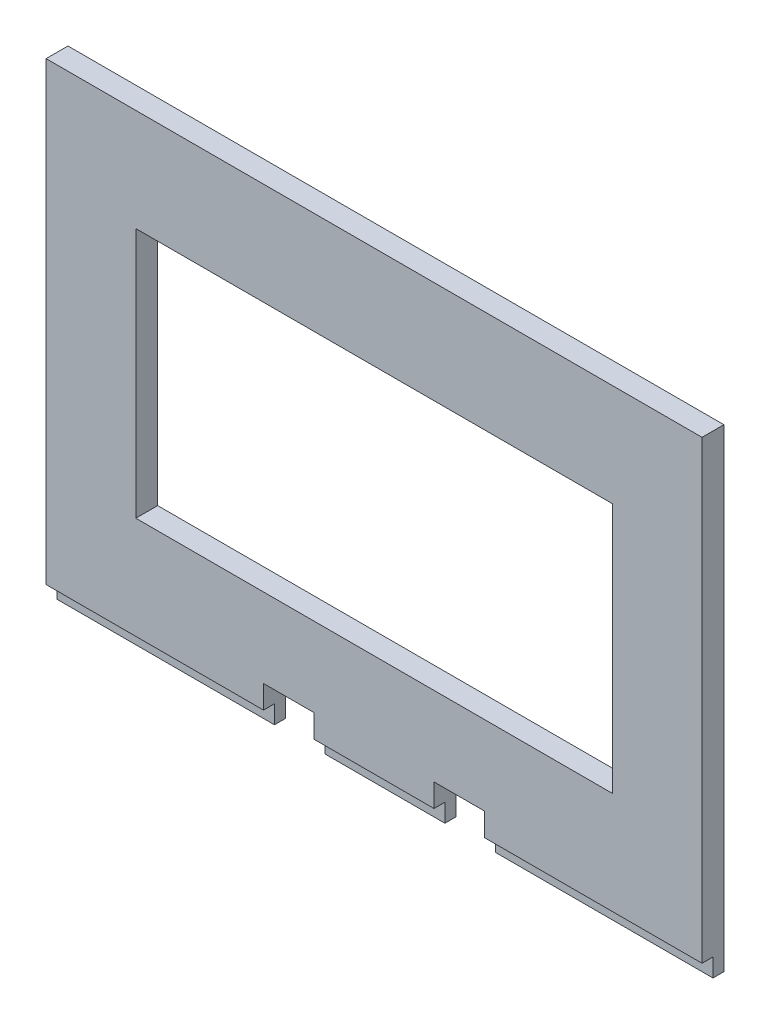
SolidWorks part; units mm, degrees
ref_plane "前视基准面" through (0, 0, 0) normal (0, 0, 1) x (1, 0, 0)
ref_plane "上视基准面" through (0, 0, 0) normal (0, 1, 0) x (1, 0, 0)
ref_plane "右视基准面" through (0, 0, 0) normal (1, 0, 0) x (0, 0, -1)
other "Configuration Table"
sketch "草图1" plane through (0, 0, 0) normal (0, 0, 1) x (1, 0, 0)
  line L1 (90, -62.5) -> (-90, -62.5)
  line L2 (90, -62.5) -> (90, 62.5)
  line L3 (90, 62.5) -> (-90, 62.5)
  line L4 (-90, -62.5) -> (-90, 62.5)
  line L5 (90, -62.5) -> (-90, 62.5) construction
  line L6 (90, 62.5) -> (-90, -62.5) construction
  point P0 (0, 0)
  dimension "D1" = 180
  dimension "D2" = 125
extrude "凸台-拉伸1" add sketch "草图1" along normal blind 4
sketch "草图2" plane through (0, 0, 4) normal (0, 0, 1) x (1, 0, 0)
  line L0 (-90, 62.5) -> (-90, -62.5)
  line L1 (-90, -62.5) -> (90, -62.5)
  line L2 (90, -62.5) -> (90, 62.5)
  line L3 (90, 62.5) -> (-90, 62.5)
extrude "凸台-拉伸2" add sketch "草图2" along normal blind 2
sketch "草图3" plane through (0, -62.5, 0) normal (0, -1, 0) x (1, 0, 0)
  line L0 (90, 0) -> (90, 3)
  line L2 (90, 6) -> (90, 0) construction
  line L3 (90, 3) -> (-90, 3)
  line L4 (-90, 6) -> (-90, 0) construction
  line L5 (-90, 3) -> (-90, 0)
  line L6 (90, 0) -> (-90, 0)
extrude "凸台-拉伸3" add sketch "草图3" along normal blind 5
sketch "草图4" plane through (0, 0, 6) normal (0, 0, 1) x (1, 0, 0)
  line L1 (65.3847, -34.4209) -> (-65.3847, -34.4209)
  line L2 (65.3847, -34.4209) -> (65.3847, 34.4209)
  line L3 (65.3847, 34.4209) -> (-65.3847, 34.4209)
  line L4 (-65.3847, -34.4209) -> (-65.3847, 34.4209)
  line L5 (65.3847, -34.4209) -> (-65.3847, 34.4209) construction
  line L6 (65.3847, 34.4209) -> (-65.3847, -34.4209) construction
  point P0 (0, 0)
extrude "切除-拉伸1" cut sketch "草图4" against normal through all
sketch "草图6" plane through (0, 0, 0) normal (0, 0, -1) x (-1, 0, 0)
  line L0 (-30.3326, -67.5) -> (-30.3326, -56.171)
  line L1 (90, -67.5) -> (-90, -67.5) construction
  line L2 (-30.3326, -56.171) -> (-16.4469, -56.171)
  line L3 (-16.4469, -56.171) -> (-16.4469, -67.5)
  line L4 (-23.3898, -67.5) -> (-23.3898, -53.5442) construction
  line L5 (-30.3326, -67.5) -> (-16.4469, -67.5)
extrude "切除-拉伸2" cut sketch "草图6" against normal blind 10
sketch "草图9" plane through (0, 0, 0) normal (0, 0, -1) x (-1, 0, 0)
  line L0 (30.3326, -67.5) -> (30.3326, -56.171)
  line L1 (30.3326, -56.171) -> (16.4469, -56.171)
  line L2 (16.4469, -56.171) -> (16.4469, -67.5)
  line L3 (90, -67.5) -> (-16.4469, -67.5) construction
  line L4 (16.4469, -67.5) -> (16.4469, -62.5) construction
  line L5 (16.4469, -67.5) -> (30.3326, -67.5)
extrude "切除-拉伸3" cut sketch "草图9" against normal blind 10
sketch "草图10" plane through (90, 0, 0) normal (1, 0, 0) x (0, 0, -1)
  line L0 (-6, 62.5) -> (0, 62.5)
  line L1 (0, 62.5) -> (0, -67.5)
  line L2 (0, -67.5) -> (-3, -67.5)
  line L3 (-3, -67.5) -> (-3, -62.5)
  line L4 (-3, -67.5) -> (-3, -62.5) construction
  line L5 (-3, -62.5) -> (-6, -62.5)
  line L6 (-6, -62.5) -> (-6, 62.5)
